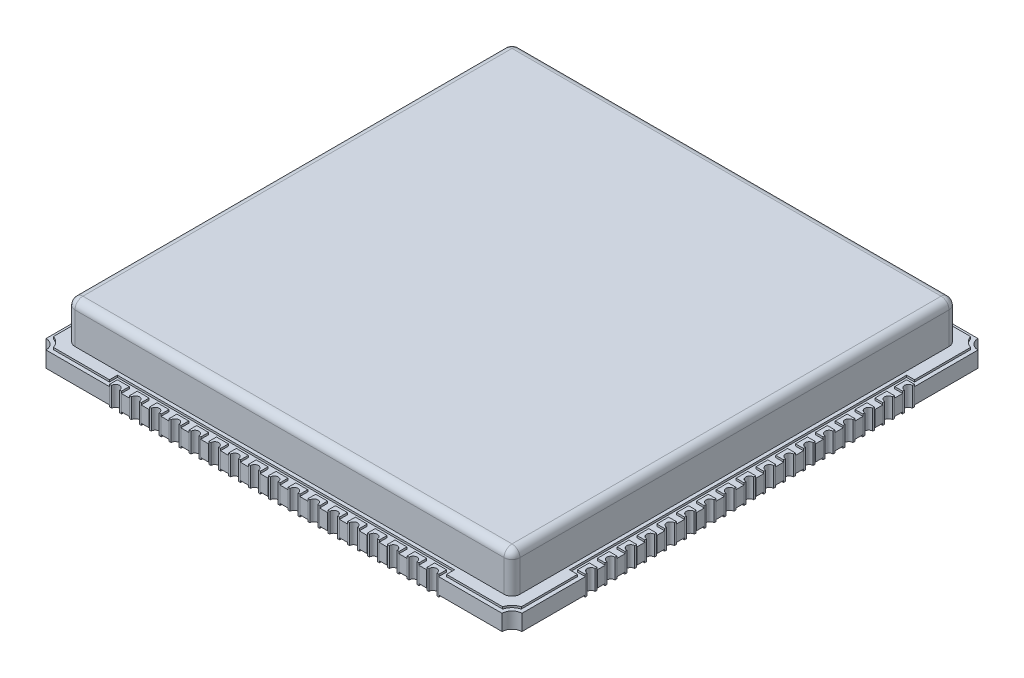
SolidWorks part; units mm, degrees
ref_plane "Front" through (0, 0, 0) normal (0, 0, 1) x (1, 0, 0)
ref_plane "Top" through (0, 0, 0) normal (0, 1, 0) x (1, 0, 0)
ref_plane "Right" through (0, 0, 0) normal (1, 0, 0) x (0, 0, -1)
sketch "Эскиз1" plane through (0, 0, 0) normal (0, 1, 0) x (1, 0, 0)
  line L1 (-12, -12) -> (12, -12)
  line L2 (-12, -12) -> (-12, 12)
  line L3 (-12, 12) -> (12, 12)
  line L4 (12, -12) -> (12, 12)
  line L5 (-12, -12) -> (12, 12) construction
  line L6 (-12, 12) -> (12, -12) construction
  point P0 (0, 0)
  dimension "D1" = 24
extrude "Вытянуть1" add sketch "Эскиз1" along normal blind 1
sketch "Эскиз3" plane through (0, 1, 0) normal (0, 1, 0) x (1, 0, 0)
  line L0 (-12, 12) -> (-12, -12) construction
  line L1 (-12, 8.3) -> (-11.8, 8.3)
  line L2 (-12, 8.3) -> (-12, 7.7)
  line L3 (-12, 7.7) -> (-11.8, 7.7)
  line L4 (-11.8, 8.3) -> (-11.8, 7.7)
  line L5 (12, 12) -> (-12, 12) construction
  line L6 (-8.3, 12) -> (-7.7, 12)
  line L7 (-8.3, 12) -> (-8.3, 11.8)
  line L8 (-8.3, 11.8) -> (-7.7, 11.8)
  line L9 (-7.7, 12) -> (-7.7, 11.8)
  line L10 (-12, 8) -> (-11.8, 8) construction
  line L11 (-8, 12) -> (-8, 11.8) construction
  line L12 (-7.3, 12) -> (-6.7, 12)
  line L13 (-7.3, 12) -> (-7.3, 11.8)
  line L14 (-7.3, 11.8) -> (-6.7, 11.8)
  line L15 (-6.7, 12) -> (-6.7, 11.8)
  line L16 (-6.3, 12) -> (-5.7, 12)
  line L17 (-6.3, 12) -> (-6.3, 11.8)
  line L18 (-6.3, 11.8) -> (-5.7, 11.8)
  line L19 (-5.7, 12) -> (-5.7, 11.8)
  line L20 (-5.3, 12) -> (-4.7, 12)
  line L21 (-5.3, 12) -> (-5.3, 11.8)
  line L22 (-5.3, 11.8) -> (-4.7, 11.8)
  line L23 (-4.7, 12) -> (-4.7, 11.8)
  line L24 (-4.3, 12) -> (-3.7, 12)
  line L25 (-4.3, 12) -> (-4.3, 11.8)
  line L26 (-4.3, 11.8) -> (-3.7, 11.8)
  line L27 (-3.7, 12) -> (-3.7, 11.8)
  line L28 (-3.3, 12) -> (-2.7, 12)
  line L29 (-3.3, 12) -> (-3.3, 11.8)
  line L30 (-3.3, 11.8) -> (-2.7, 11.8)
  line L31 (-2.7, 12) -> (-2.7, 11.8)
  line L32 (-2.3, 12) -> (-1.7, 12)
  line L33 (-2.3, 12) -> (-2.3, 11.8)
  line L34 (-2.3, 11.8) -> (-1.7, 11.8)
  line L35 (-1.7, 12) -> (-1.7, 11.8)
  line L36 (-1.3, 12) -> (-0.7, 12)
  line L37 (-1.3, 12) -> (-1.3, 11.8)
  line L38 (-1.3, 11.8) -> (-0.7, 11.8)
  line L39 (-0.7, 12) -> (-0.7, 11.8)
  line L40 (-0.3, 12) -> (0.3, 12)
  line L41 (-0.3, 12) -> (-0.3, 11.8)
  line L42 (-0.3, 11.8) -> (0.3, 11.8)
  line L43 (0.3, 12) -> (0.3, 11.8)
  line L44 (0.7, 12) -> (1.3, 12)
  line L45 (0.7, 12) -> (0.7, 11.8)
  line L46 (0.7, 11.8) -> (1.3, 11.8)
  line L47 (1.3, 12) -> (1.3, 11.8)
  line L48 (1.7, 12) -> (2.3, 12)
  line L49 (1.7, 12) -> (1.7, 11.8)
  line L50 (1.7, 11.8) -> (2.3, 11.8)
  line L51 (2.3, 12) -> (2.3, 11.8)
  line L52 (2.7, 12) -> (3.3, 12)
  line L53 (2.7, 12) -> (2.7, 11.8)
  line L54 (2.7, 11.8) -> (3.3, 11.8)
  line L55 (3.3, 12) -> (3.3, 11.8)
  line L56 (3.7, 12) -> (4.3, 12)
  line L57 (3.7, 12) -> (3.7, 11.8)
  line L58 (3.7, 11.8) -> (4.3, 11.8)
  line L59 (4.3, 12) -> (4.3, 11.8)
  line L60 (4.7, 12) -> (5.3, 12)
  line L61 (4.7, 12) -> (4.7, 11.8)
  line L62 (4.7, 11.8) -> (5.3, 11.8)
  line L63 (5.3, 12) -> (5.3, 11.8)
  line L64 (5.7, 12) -> (6.3, 12)
  line L65 (5.7, 12) -> (5.7, 11.8)
  line L66 (5.7, 11.8) -> (6.3, 11.8)
  line L67 (6.3, 12) -> (6.3, 11.8)
  line L68 (6.7, 12) -> (7.3, 12)
  line L69 (6.7, 12) -> (6.7, 11.8)
  line L70 (6.7, 11.8) -> (7.3, 11.8)
  line L71 (7.3, 12) -> (7.3, 11.8)
  line L72 (7.7, 12) -> (8.3, 12)
  line L73 (7.7, 12) -> (7.7, 11.8)
  line L74 (7.7, 11.8) -> (8.3, 11.8)
  line L75 (8.3, 12) -> (8.3, 11.8)
  line L76 (-8.3, -11.8) -> (-7.7, -11.8)
  line L77 (-8.3, -11.8) -> (-8.3, -12)
  line L78 (-8.3, -12) -> (-7.7, -12)
  line L79 (-7.7, -11.8) -> (-7.7, -12)
  line L80 (-7.3, -11.8) -> (-6.7, -11.8)
  line L81 (-7.3, -11.8) -> (-7.3, -12)
  line L82 (-7.3, -12) -> (-6.7, -12)
  line L83 (-6.7, -11.8) -> (-6.7, -12)
  line L84 (-6.3, -11.8) -> (-5.7, -11.8)
  line L85 (-6.3, -11.8) -> (-6.3, -12)
  line L86 (-6.3, -12) -> (-5.7, -12)
  line L87 (-5.7, -11.8) -> (-5.7, -12)
  line L88 (-5.3, -11.8) -> (-4.7, -11.8)
  line L89 (-5.3, -11.8) -> (-5.3, -12)
  line L90 (-5.3, -12) -> (-4.7, -12)
  line L91 (-4.7, -11.8) -> (-4.7, -12)
  line L92 (-4.3, -11.8) -> (-3.7, -11.8)
  line L93 (-4.3, -11.8) -> (-4.3, -12)
  line L94 (-4.3, -12) -> (-3.7, -12)
  line L95 (-3.7, -11.8) -> (-3.7, -12)
  line L96 (-3.3, -11.8) -> (-2.7, -11.8)
  line L97 (-3.3, -11.8) -> (-3.3, -12)
  line L98 (-3.3, -12) -> (-2.7, -12)
  line L99 (-2.7, -11.8) -> (-2.7, -12)
  line L100 (-2.3, -11.8) -> (-1.7, -11.8)
  line L101 (-2.3, -11.8) -> (-2.3, -12)
  line L102 (-2.3, -12) -> (-1.7, -12)
  line L103 (-1.7, -11.8) -> (-1.7, -12)
  line L104 (-1.3, -11.8) -> (-0.7, -11.8)
  line L105 (-1.3, -11.8) -> (-1.3, -12)
  line L106 (-1.3, -12) -> (-0.7, -12)
  line L107 (-0.7, -11.8) -> (-0.7, -12)
  line L108 (-0.3, -11.8) -> (0.3, -11.8)
  line L109 (-0.3, -11.8) -> (-0.3, -12)
  line L110 (-0.3, -12) -> (0.3, -12)
  line L111 (0.3, -11.8) -> (0.3, -12)
  line L112 (0.7, -11.8) -> (1.3, -11.8)
  line L113 (0.7, -11.8) -> (0.7, -12)
  line L114 (0.7, -12) -> (1.3, -12)
  line L115 (1.3, -11.8) -> (1.3, -12)
  line L116 (1.7, -11.8) -> (2.3, -11.8)
  line L117 (1.7, -11.8) -> (1.7, -12)
  line L118 (1.7, -12) -> (2.3, -12)
  line L119 (2.3, -11.8) -> (2.3, -12)
  line L120 (2.7, -11.8) -> (3.3, -11.8)
  line L121 (2.7, -11.8) -> (2.7, -12)
  line L122 (2.7, -12) -> (3.3, -12)
  line L123 (3.3, -11.8) -> (3.3, -12)
  line L124 (3.7, -11.8) -> (4.3, -11.8)
  line L125 (3.7, -11.8) -> (3.7, -12)
  line L126 (3.7, -12) -> (4.3, -12)
  line L127 (4.3, -11.8) -> (4.3, -12)
  line L128 (4.7, -11.8) -> (5.3, -11.8)
  line L129 (4.7, -11.8) -> (4.7, -12)
  line L130 (4.7, -12) -> (5.3, -12)
  line L131 (5.3, -11.8) -> (5.3, -12)
  line L132 (5.7, -11.8) -> (6.3, -11.8)
  line L133 (5.7, -11.8) -> (5.7, -12)
  line L134 (5.7, -12) -> (6.3, -12)
  line L135 (6.3, -11.8) -> (6.3, -12)
  line L136 (6.7, -11.8) -> (7.3, -11.8)
  line L137 (6.7, -11.8) -> (6.7, -12)
  line L138 (6.7, -12) -> (7.3, -12)
  line L139 (7.3, -11.8) -> (7.3, -12)
  line L140 (7.7, -11.8) -> (8.3, -11.8)
  line L141 (7.7, -11.8) -> (7.7, -12)
  line L142 (7.7, -12) -> (8.3, -12)
  line L143 (8.3, -11.8) -> (8.3, -12)
  line L144 (-12, -12) -> (12, -12) construction
  line L145 (11.8, 8.3) -> (12, 8.3)
  line L146 (11.8, 8.3) -> (11.8, 7.7)
  line L147 (11.8, 7.7) -> (12, 7.7)
  line L148 (12, 8.3) -> (12, 7.7)
  line L149 (-12, 7.3) -> (-11.8, 7.3)
  line L150 (-12, 7.3) -> (-12, 6.7)
  line L151 (-12, 6.7) -> (-11.8, 6.7)
  line L152 (-11.8, 7.3) -> (-11.8, 6.7)
  line L153 (11.8, 7.3) -> (12, 7.3)
  line L154 (11.8, 7.3) -> (11.8, 6.7)
  line L155 (11.8, 6.7) -> (12, 6.7)
  line L156 (12, 7.3) -> (12, 6.7)
  line L157 (-12, 6.3) -> (-11.8, 6.3)
  line L158 (-12, 6.3) -> (-12, 5.7)
  line L159 (-12, 5.7) -> (-11.8, 5.7)
  line L160 (-11.8, 6.3) -> (-11.8, 5.7)
  line L161 (11.8, 6.3) -> (12, 6.3)
  line L162 (11.8, 6.3) -> (11.8, 5.7)
  line L163 (11.8, 5.7) -> (12, 5.7)
  line L164 (12, 6.3) -> (12, 5.7)
  line L165 (-12, 5.3) -> (-11.8, 5.3)
  line L166 (-12, 5.3) -> (-12, 4.7)
  line L167 (-12, 4.7) -> (-11.8, 4.7)
  line L168 (-11.8, 5.3) -> (-11.8, 4.7)
  line L169 (11.8, 5.3) -> (12, 5.3)
  line L170 (11.8, 5.3) -> (11.8, 4.7)
  line L171 (11.8, 4.7) -> (12, 4.7)
  line L172 (12, 5.3) -> (12, 4.7)
  line L173 (-12, 4.3) -> (-11.8, 4.3)
  line L174 (-12, 4.3) -> (-12, 3.7)
  line L175 (-12, 3.7) -> (-11.8, 3.7)
  line L176 (-11.8, 4.3) -> (-11.8, 3.7)
  line L177 (11.8, 4.3) -> (12, 4.3)
  line L178 (11.8, 4.3) -> (11.8, 3.7)
  line L179 (11.8, 3.7) -> (12, 3.7)
  line L180 (12, 4.3) -> (12, 3.7)
  line L181 (-12, 3.3) -> (-11.8, 3.3)
  line L182 (-12, 3.3) -> (-12, 2.7)
  line L183 (-12, 2.7) -> (-11.8, 2.7)
  line L184 (-11.8, 3.3) -> (-11.8, 2.7)
  line L185 (11.8, 3.3) -> (12, 3.3)
  line L186 (11.8, 3.3) -> (11.8, 2.7)
  line L187 (11.8, 2.7) -> (12, 2.7)
  line L188 (12, 3.3) -> (12, 2.7)
  line L189 (-12, 2.3) -> (-11.8, 2.3)
  line L190 (-12, 2.3) -> (-12, 1.7)
  line L191 (-12, 1.7) -> (-11.8, 1.7)
  line L192 (-11.8, 2.3) -> (-11.8, 1.7)
  line L193 (11.8, 2.3) -> (12, 2.3)
  line L194 (11.8, 2.3) -> (11.8, 1.7)
  line L195 (11.8, 1.7) -> (12, 1.7)
  line L196 (12, 2.3) -> (12, 1.7)
  line L197 (-12, 1.3) -> (-11.8, 1.3)
  line L198 (-12, 1.3) -> (-12, 0.7)
  line L199 (-12, 0.7) -> (-11.8, 0.7)
  line L200 (-11.8, 1.3) -> (-11.8, 0.7)
  line L201 (11.8, 1.3) -> (12, 1.3)
  line L202 (11.8, 1.3) -> (11.8, 0.7)
  line L203 (11.8, 0.7) -> (12, 0.7)
  line L204 (12, 1.3) -> (12, 0.7)
  line L205 (-12, 0.3) -> (-11.8, 0.3)
  line L206 (-12, 0.3) -> (-12, -0.3)
  line L207 (-12, -0.3) -> (-11.8, -0.3)
  line L208 (-11.8, 0.3) -> (-11.8, -0.3)
  line L209 (11.8, 0.3) -> (12, 0.3)
  line L210 (11.8, 0.3) -> (11.8, -0.3)
  line L211 (11.8, -0.3) -> (12, -0.3)
  line L212 (12, 0.3) -> (12, -0.3)
  line L213 (-12, -0.7) -> (-11.8, -0.7)
  line L214 (-12, -0.7) -> (-12, -1.3)
  line L215 (-12, -1.3) -> (-11.8, -1.3)
  line L216 (-11.8, -0.7) -> (-11.8, -1.3)
  line L217 (11.8, -0.7) -> (12, -0.7)
  line L218 (11.8, -0.7) -> (11.8, -1.3)
  line L219 (11.8, -1.3) -> (12, -1.3)
  line L220 (12, -0.7) -> (12, -1.3)
  line L221 (-12, -1.7) -> (-11.8, -1.7)
  line L222 (-12, -1.7) -> (-12, -2.3)
  line L223 (-12, -2.3) -> (-11.8, -2.3)
  line L224 (-11.8, -1.7) -> (-11.8, -2.3)
  line L225 (11.8, -1.7) -> (12, -1.7)
  line L226 (11.8, -1.7) -> (11.8, -2.3)
  line L227 (11.8, -2.3) -> (12, -2.3)
  line L228 (12, -1.7) -> (12, -2.3)
  line L229 (-12, -2.7) -> (-11.8, -2.7)
  line L230 (-12, -2.7) -> (-12, -3.3)
  line L231 (-12, -3.3) -> (-11.8, -3.3)
  line L232 (-11.8, -2.7) -> (-11.8, -3.3)
  line L233 (11.8, -2.7) -> (12, -2.7)
  line L234 (11.8, -2.7) -> (11.8, -3.3)
  line L235 (11.8, -3.3) -> (12, -3.3)
  line L236 (12, -2.7) -> (12, -3.3)
  line L237 (-12, -3.7) -> (-11.8, -3.7)
  line L238 (-12, -3.7) -> (-12, -4.3)
  line L239 (-12, -4.3) -> (-11.8, -4.3)
  line L240 (-11.8, -3.7) -> (-11.8, -4.3)
  line L241 (11.8, -3.7) -> (12, -3.7)
  line L242 (11.8, -3.7) -> (11.8, -4.3)
  line L243 (11.8, -4.3) -> (12, -4.3)
  line L244 (12, -3.7) -> (12, -4.3)
  line L245 (-12, -4.7) -> (-11.8, -4.7)
  line L246 (-12, -4.7) -> (-12, -5.3)
  line L247 (-12, -5.3) -> (-11.8, -5.3)
  line L248 (-11.8, -4.7) -> (-11.8, -5.3)
  line L249 (11.8, -4.7) -> (12, -4.7)
  line L250 (11.8, -4.7) -> (11.8, -5.3)
  line L251 (11.8, -5.3) -> (12, -5.3)
  line L252 (12, -4.7) -> (12, -5.3)
  line L253 (-12, -5.7) -> (-11.8, -5.7)
  line L254 (-12, -5.7) -> (-12, -6.3)
  line L255 (-12, -6.3) -> (-11.8, -6.3)
  line L256 (-11.8, -5.7) -> (-11.8, -6.3)
  line L257 (11.8, -5.7) -> (12, -5.7)
  line L258 (11.8, -5.7) -> (11.8, -6.3)
  line L259 (11.8, -6.3) -> (12, -6.3)
  line L260 (12, -5.7) -> (12, -6.3)
  line L261 (-12, -6.7) -> (-11.8, -6.7)
  line L262 (-12, -6.7) -> (-12, -7.3)
  line L263 (-12, -7.3) -> (-11.8, -7.3)
  line L264 (-11.8, -6.7) -> (-11.8, -7.3)
  line L265 (11.8, -6.7) -> (12, -6.7)
  line L266 (11.8, -6.7) -> (11.8, -7.3)
  line L267 (11.8, -7.3) -> (12, -7.3)
  line L268 (12, -6.7) -> (12, -7.3)
  line L269 (-12, -7.7) -> (-11.8, -7.7)
  line L270 (-12, -7.7) -> (-12, -8.3)
  line L271 (-12, -8.3) -> (-11.8, -8.3)
  line L272 (-11.8, -7.7) -> (-11.8, -8.3)
  line L273 (11.8, -7.7) -> (12, -7.7)
  line L274 (11.8, -7.7) -> (11.8, -8.3)
  line L275 (11.8, -8.3) -> (12, -8.3)
  line L276 (12, -7.7) -> (12, -8.3)
  line L277 (12, -12) -> (12, 12) construction
  circle A0 centre (-12, 12) radius 0.5
  circle A1 centre (12, 12) radius 0.5
  circle A2 centre (12, -12) radius 0.5
  circle A3 centre (-12, -12) radius 0.5
  dimension "D1" = 1
  dimension "D2" = 0.6
  dimension "A" = 8
  dimension "D3" = 0.2
  dimension "D4" = 1
  dimension "D5" = 1
extrude "Вытянуть3" cut sketch "Эскиз3" against normal through all
sketch "Эскиз4" plane through (0, 1, 0) normal (0, 1, 0) x (1, 0, 0)
  line L18 (-11.8, -8.5) -> (-11.8, -11.3292)
  line L19 (-8.5, 11.8) -> (-11.3292, 11.8)
  line L22 (-8.5, 11.8) -> (-8.5, 11.4)
  line L24 (-8.5, 11.4) -> (8.5, 11.4)
  line L29 (-11.8, 11.8) -> (-11.8, -11.8)
  line L33 (-11.8, -11.8) -> (11.8, -11.8)
  line L34 (11.8, -11.8) -> (11.8, 11.8)
  line L35 (11.8, 11.8) -> (-11.8, 11.8)
  line L36 (-11.8, 11.3292) -> (-11.8, 8.5)
  line L37 (-11.3292, -11.8) -> (-8.5, -11.8)
  line L38 (11.8, -11.3292) -> (11.8, -8.5)
  line L39 (11.3292, 11.8) -> (8.5, 11.8)
  line L40 (8.5, 11.8) -> (8.5, 11.4)
  line L41 (-11.8, 8.5) -> (-11.4, 8.5)
  line L42 (11.8, 8.5) -> (11.8, 11.3292)
  line L43 (-11.8, -8.5) -> (-11.4, -8.5)
  line L44 (-11.4, 8.5) -> (-11.4, -8.5)
  line L45 (-11.8, 8.3) -> (-12, 8.3) construction
  line L46 (-8.5, -11.8) -> (-8.5, -11.4)
  line L47 (-8.5, -11.4) -> (8.5, -11.4)
  line L48 (8.5, -11.8) -> (8.5, -11.4)
  line L49 (11.8, -8.5) -> (11.4, -8.5)
  line L50 (8.5, -11.8) -> (11.3292, -11.8)
  line L51 (11.8, 8.5) -> (11.4, 8.5)
  line L52 (11.4, -8.5) -> (11.4, 8.5)
  line L53 (-11.8, 7.7) -> (-11.8, 8.3) construction
  line L54 (-12, -8.3) -> (-11.8, -8.3) construction
  line L55 (-8.3, 12) -> (-8.3, 11.8) construction
  line L56 (12, 8.3) -> (11.8, 8.3) construction
  line L57 (-8.3, -11.8) -> (-8.3, -12) construction
  arc A4 (-11.5, -12) -> (-12, -11.5) centre (-12, -12) ccw construction
  arc A5 (12, -11.5) -> (11.5, -12) centre (12, -12) ccw construction
  arc A6 (11.5, 12) -> (12, 11.5) centre (12, 12) ccw construction
  arc A7 (-12, 11.5) -> (-11.5, 12) centre (-12, 12) ccw construction
  arc A28 (-11.5, -12) -> (-12, -11.5) centre (-12, -12) ccw construction
  arc A29 (12, -11.5) -> (11.5, -12) centre (12, -12) ccw construction
  arc A30 (11.5, 12) -> (12, 11.5) centre (12, 12) ccw construction
  arc A31 (-12, 11.5) -> (-11.5, 12) centre (-12, 12) ccw construction
  arc A32 (-11.8, 11.3292) -> (-11.3292, 11.8) centre (-12, 12) ccw
  arc A33 (11.3292, 11.8) -> (11.8, 11.3292) centre (12, 12) ccw
  arc A34 (11.8, -11.3292) -> (11.3292, -11.8) centre (12, -12) ccw
  arc A35 (-11.3292, -11.8) -> (-11.8, -11.3292) centre (-12, -12) ccw
  arc A37 (12, -11.3) -> (11.3, -12) centre (12, -12) ccw construction
  arc A38 (11.3, 12) -> (12, 11.3) centre (12, 12) ccw construction
  arc A39 (11.5, 12) -> (12, 11.5) centre (12, 12) ccw construction
  arc A40 (-12, 11.3) -> (-11.3, 12) centre (-12, 12) ccw construction
  arc A41 (-11.3, -12) -> (-12, -11.3) centre (-12, -12) ccw construction
  point P2 (-11.8, 11.3292)
  point P4 (-11.8, -11.3292)
  point P10 (-11.3292, -11.8)
  point P16 (11.3292, -11.8)
  point P18 (11.8, -11.3292)
  point P19 (11.8, 11.3292)
  point P21 (11.3292, 11.8)
  point P22 (-11.3292, 11.8)
  dimension "D3" = 0.2
  dimension "D4" = 0.4
  dimension "D5" = 0.2
  dimension "D6" = 0.2
  dimension "D7" = 0.2
  dimension "D8" = 0.2
  dimension "D1" = 0.2
  dimension "D2" = 0.2
extrude "Вытянуть4" cut sketch "Эскиз4" against normal blind 0.1 flip side to cut
sketch "Эскиз5" plane through (0, 0, 0) normal (0, -1, 0) x (1, 0, 0)
  line L0 (-12, -12.5) -> (-12, -8.3) construction
  line L1 (-8.5, -10.8) -> (8.5, -10.8)
  line L2 (-10.8, -8.5) -> (-10.8, 8.5)
  line L3 (-8.5, 10.8) -> (8.5, 10.8)
  line L4 (10.8, -8.5) -> (10.8, 8.5)
  line L5 (-8.3, -12) -> (-11.5, -12) construction
  line L10 (12, -8.3) -> (12, -11.5) construction
  line L13 (-6.5, 0) -> (0, 0) construction
  line L20 (-8.5, 11.8) -> (-11.3292, 11.8)
  line L21 (-8.5, 11.4) -> (-8.5, 11.8)
  line L22 (8.5, 11.4) -> (-8.5, 11.4)
  line L23 (8.5, 11.8) -> (8.5, 11.4)
  line L24 (11.3292, 11.8) -> (8.5, 11.8)
  line L25 (11.8, 8.5) -> (11.8, 11.3292)
  line L26 (11.4, 8.5) -> (11.8, 8.5)
  line L27 (11.4, -8.5) -> (11.4, 8.5)
  line L28 (11.8, -8.5) -> (11.4, -8.5)
  line L29 (11.8, -11.3292) -> (11.8, -8.5)
  line L30 (8.5, -11.8) -> (11.3292, -11.8)
  line L31 (8.5, -11.4) -> (8.5, -11.8)
  line L32 (-8.5, -11.4) -> (8.5, -11.4)
  line L33 (-8.5, -11.8) -> (-8.5, -11.4)
  line L34 (-11.3292, -11.8) -> (-8.5, -11.8)
  line L35 (-11.8, -8.5) -> (-11.8, -11.3292)
  line L36 (-11.4, -8.5) -> (-11.8, -8.5)
  line L37 (-11.4, 8.5) -> (-11.4, -8.5)
  line L38 (-11.8, 8.5) -> (-11.4, 8.5)
  line L39 (-11.8, 11.3292) -> (-11.8, 8.5)
  line L40 (-8.5, 11.8) -> (-11.3292, 11.8)
  line L41 (-8.5, 10.8) -> (-8.5, 11.8)
  line L43 (8.5, 11.8) -> (8.5, 10.8)
  line L44 (11.3292, 11.8) -> (8.5, 11.8)
  line L45 (11.8, 8.5) -> (11.8, 11.3292)
  line L46 (10.8, 8.5) -> (11.8, 8.5)
  line L48 (11.8, -8.5) -> (10.8, -8.5)
  line L49 (11.8, -11.3292) -> (11.8, -8.5)
  line L50 (8.5, -11.8) -> (11.3292, -11.8)
  line L51 (8.5, -10.8) -> (8.5, -11.8)
  line L53 (-8.5, -11.8) -> (-8.5, -10.8)
  line L54 (-11.3292, -11.8) -> (-8.5, -11.8)
  line L55 (-11.8, -8.5) -> (-11.8, -11.3292)
  line L56 (-10.8, -8.5) -> (-11.8, -8.5)
  line L58 (-11.8, 8.5) -> (-10.8, 8.5)
  line L59 (-11.8, 11.3292) -> (-11.8, 8.5)
  circle A0 centre (-0.5, -8) radius 1.5
  circle A1 centre (-6.5, 2) radius 0.75
  circle A2 centre (-4.5, 2) radius 0.75
  circle A3 centre (-2.5, 2) radius 0.75
  arc A4 (-11.8, 11.3292) -> (-11.3292, 11.8) centre (-12, 12) ccw
  arc A5 (11.3292, 11.8) -> (11.8, 11.3292) centre (12, 12) ccw
  arc A6 (11.8, -11.3292) -> (11.3292, -11.8) centre (12, -12) ccw
  arc A7 (-11.3292, -11.8) -> (-11.8, -11.3292) centre (-12, -12) ccw
  arc A8 (-11.8, 11.3292) -> (-11.3292, 11.8) centre (-12, 12) ccw
  arc A9 (11.3292, 11.8) -> (11.8, 11.3292) centre (12, 12) ccw
  arc A10 (11.8, -11.3292) -> (11.3292, -11.8) centre (12, -12) ccw
  arc A11 (-11.3292, -11.8) -> (-11.8, -11.3292) centre (-12, -12) ccw
  circle A12 centre (-6.5, 0) radius 0.75
  circle A13 centre (-4.5, 0) radius 0.75
  circle A14 centre (-2.5, 0) radius 0.75
  circle A15 centre (-6.5, -2) radius 0.75
  circle A16 centre (-4.5, -2) radius 0.75
  circle A17 centre (-2.5, -2) radius 0.75
  dimension "D4" = 12.5
  dimension "D9" = 2
  dimension "D10" = 2
  dimension "D11" = 1.5
  dimension "D12" = 6.5
  dimension "D5" = 3
  dimension "D3" = 4
  dimension "D2" = 1.2
  dimension "D1" = 0
extrude "Вытянуть5" cut sketch "Эскиз5" against normal blind 0.1 flip side to cut
ref_plane "Плоскость1" through (0, 0, -8) normal (0, 0, 1) x (1, 0, 0)
sketch "Эскиз9" plane through (0, 0, -8) normal (0, 0, 1) x (1, 0, 0)
  line L0 (-11.99, 1) -> (-11.99, 0)
  line L1 (-11.99, 0) -> (-11, 0)
  line L2 (-10.8, 0) -> (-11.8, 0) construction
  line L5 (-11, 0) -> (-11, 0.1)
  line L6 (0, 0) -> (0, 1) construction
  line L8 (-11, 0.1) -> (-11.6, 0.1)
  line L10 (-11.6, 0.1) -> (-11.6, 1)
  line L11 (-11.8, 1) -> (-11.4, 1) construction
  line L12 (-11.6, 1) -> (-11.99, 1)
  line L13 (-12, 0.1) -> (-12, 0.9) construction
  line L14 (-11.4, 0.9) -> (-11.4, 1) construction
  line L15 (-10.8, 0.1) -> (-10.8, 0) construction
  line L16 (-8.5, 1) -> (8.5, 1) construction
  line L17 (11.6, 1) -> (11.99, 1)
  line L18 (11.6, 0.1) -> (11.6, 1)
  line L19 (11, 0.1) -> (11.6, 0.1)
  line L20 (11, 0) -> (11, 0.1)
  line L21 (11.99, 0) -> (11, 0)
  line L22 (11.99, 1) -> (11.99, 0)
  line L23 (-11.8, 0.1) -> (-12, 0.1) construction
  dimension "D1" = 0.01
  dimension "D2" = 0.2
  dimension "D3" = 0.2
extrude "Вытянуть7" add sketch "Эскиз9" along normal mid plane 0.6
ref_plane "Плоскость2" through (-8, 0, 0) normal (1, 0, 0) x (0, 0, -1)
sketch "Эскиз10" plane through (-8, 0, 0) normal (1, 0, 0) x (0, 0, -1)
  line L0 (11.6, 0.1) -> (11.6, 1)
  line L2 (11.4, 1) -> (11.8, 1) construction
  line L3 (11.6, 1) -> (11.99, 1)
  line L4 (11.99, 1) -> (11.99, 0)
  line L5 (11.99, 0) -> (11, 0)
  line L6 (11.8, 0) -> (10.8, 0) construction
  line L7 (11, 0) -> (11, 0.1)
  line L9 (11, 0.1) -> (11.6, 0.1)
  line L10 (12, 0.1) -> (12, 0.9) construction
  line L11 (11.4, 0.9) -> (11.4, 1) construction
  line L12 (10.8, 0.1) -> (10.8, 0) construction
  line L13 (0, 0) -> (0, 1) construction
  line L14 (8.5, 1) -> (-8.5, 1) construction
  line L15 (-11, 0.1) -> (-11.6, 0.1)
  line L16 (-11, 0) -> (-11, 0.1)
  line L17 (-11.99, 0) -> (-11, 0)
  line L18 (-11.99, 1) -> (-11.99, 0)
  line L19 (-11.6, 1) -> (-11.99, 1)
  line L20 (-11.6, 0.1) -> (-11.6, 1)
  line L21 (12, 0.1) -> (11.8, 0.1) construction
  dimension "D1" = 0.01
  dimension "D2" = 0.2
  dimension "D3" = 0.2
extrude "Вытянуть8" add sketch "Эскиз10" along normal mid plane 0.6
pattern_linear "Линейный массив1" count 17 spacing 1 along (0, 0, 1) of "Вытянуть7"
pattern_linear "Линейный массив2" count 17 spacing 1 along (1, 0, 0) of "Вытянуть8"
sketch "Эскиз11" plane through (0, 1, 0) normal (0, 1, 0) x (1, 0, 0)
  line L0 (-11.99, 7.7) -> (-11.99, 8.3) construction
  line L1 (-7.7, 11.99) -> (-8.3, 11.99) construction
  line L2 (-11.99, 6.7) -> (-11.99, 7.3) construction
  line L3 (11.99, 7.7) -> (11.99, 8.3) construction
  line L4 (-6.7, 11.99) -> (-7.3, 11.99) construction
  line L5 (-7.7, -11.99) -> (-8.3, -11.99) construction
  circle A0 centre (-11.99, 8) radius 0.2
  circle A1 centre (-8, 11.99) radius 0.2
  circle A2 centre (11.99, 8) radius 0.2
  circle A3 centre (-11.99, 7) radius 0.2
  circle A4 centre (11.99, 7) radius 0.2
  circle A5 centre (-11.99, 6) radius 0.2
  circle A6 centre (11.99, 6) radius 0.2
  circle A7 centre (-11.99, 5) radius 0.2
  circle A8 centre (11.99, 5) radius 0.2
  circle A9 centre (-11.99, 4) radius 0.2
  circle A10 centre (11.99, 4) radius 0.2
  circle A11 centre (-11.99, 3) radius 0.2
  circle A12 centre (11.99, 3) radius 0.2
  circle A13 centre (-11.99, 2) radius 0.2
  circle A14 centre (11.99, 2) radius 0.2
  circle A15 centre (-11.99, 1) radius 0.2
  circle A16 centre (11.99, 1) radius 0.2
  circle A17 centre (-11.99, 0) radius 0.2
  circle A18 centre (11.99, 0) radius 0.2
  circle A19 centre (-11.99, -1) radius 0.2
  circle A20 centre (11.99, -1) radius 0.2
  circle A21 centre (-11.99, -2) radius 0.2
  circle A22 centre (11.99, -2) radius 0.2
  circle A23 centre (-11.99, -3) radius 0.2
  circle A24 centre (11.99, -3) radius 0.2
  circle A25 centre (-11.99, -4) radius 0.2
  circle A26 centre (11.99, -4) radius 0.2
  circle A27 centre (-11.99, -5) radius 0.2
  circle A28 centre (11.99, -5) radius 0.2
  circle A29 centre (-11.99, -6) radius 0.2
  circle A30 centre (11.99, -6) radius 0.2
  circle A31 centre (-11.99, -7) radius 0.2
  circle A32 centre (11.99, -7) radius 0.2
  circle A33 centre (-11.99, -8) radius 0.2
  circle A34 centre (11.99, -8) radius 0.2
  circle A35 centre (-7, 11.99) radius 0.2
  circle A36 centre (-6, 11.99) radius 0.2
  circle A37 centre (-5, 11.99) radius 0.2
  circle A38 centre (-4, 11.99) radius 0.2
  circle A39 centre (-3, 11.99) radius 0.2
  circle A40 centre (-2, 11.99) radius 0.2
  circle A41 centre (-1, 11.99) radius 0.2
  circle A42 centre (0, 11.99) radius 0.2
  circle A43 centre (1, 11.99) radius 0.2
  circle A44 centre (2, 11.99) radius 0.2
  circle A45 centre (3, 11.99) radius 0.2
  circle A46 centre (4, 11.99) radius 0.2
  circle A47 centre (5, 11.99) radius 0.2
  circle A48 centre (6, 11.99) radius 0.2
  circle A49 centre (7, 11.99) radius 0.2
  circle A50 centre (8, 11.99) radius 0.2
  circle A51 centre (-8, -11.99) radius 0.2
  circle A52 centre (-7, -11.99) radius 0.2
  circle A53 centre (-6, -11.99) radius 0.2
  circle A54 centre (-5, -11.99) radius 0.2
  circle A55 centre (-4, -11.99) radius 0.2
  circle A56 centre (-3, -11.99) radius 0.2
  circle A57 centre (-2, -11.99) radius 0.2
  circle A58 centre (-1, -11.99) radius 0.2
  circle A59 centre (0, -11.99) radius 0.2
  circle A60 centre (1, -11.99) radius 0.2
  circle A61 centre (2, -11.99) radius 0.2
  circle A62 centre (3, -11.99) radius 0.2
  circle A63 centre (4, -11.99) radius 0.2
  circle A64 centre (5, -11.99) radius 0.2
  circle A65 centre (6, -11.99) radius 0.2
  circle A66 centre (7, -11.99) radius 0.2
  circle A67 centre (8, -11.99) radius 0.2
  dimension "D1" = 0.4
extrude "Вытянуть9" cut sketch "Эскиз11" against normal through all
sketch "Эскиз12" plane through (0, 0.1, 0) normal (0, -1, 0) x (1, 0, 0)
  circle A0 centre (-2.5, 2) radius 0.75 construction
  circle A1 centre (-2.5, 0) radius 0.75 construction
  circle A2 centre (-4.5, 0) radius 0.75 construction
  circle A3 centre (-4.5, 2) radius 0.75 construction
  circle A4 centre (-6.5, 2) radius 0.75 construction
  circle A5 centre (-6.5, 0) radius 0.75 construction
  circle A6 centre (-6.5, -2) radius 0.75 construction
  circle A7 centre (-4.5, -2) radius 0.75 construction
  circle A8 centre (-2.5, -2) radius 0.75 construction
  circle A9 centre (-0.5, -8) radius 1.5 construction
  circle A30 centre (-2.5, 2) radius 0.75 construction
  circle A31 centre (-2.5, 0) radius 0.75 construction
  circle A32 centre (-4.5, 0) radius 0.75 construction
  circle A33 centre (-4.5, 2) radius 0.75 construction
  circle A34 centre (-6.5, 2) radius 0.75 construction
  circle A35 centre (-6.5, 0) radius 0.75 construction
  circle A36 centre (-6.5, -2) radius 0.75 construction
  circle A37 centre (-4.5, -2) radius 0.75 construction
  circle A38 centre (-2.5, -2) radius 0.75 construction
  circle A39 centre (-0.5, -8) radius 1.5 construction
  circle A40 centre (-2.5, 2) radius 0.55
  circle A41 centre (-2.5, 0) radius 0.55
  circle A42 centre (-4.5, 0) radius 0.55
  circle A43 centre (-4.5, 2) radius 0.55
  circle A44 centre (-6.5, 2) radius 0.55
  circle A45 centre (-6.5, 0) radius 0.55
  circle A46 centre (-6.5, -2) radius 0.55
  circle A47 centre (-4.5, -2) radius 0.55
  circle A48 centre (-2.5, -2) radius 0.55
  circle A49 centre (-0.5, -8) radius 1.3
  dimension "D1" = 0.2
extrude "Вытянуть10" add sketch "Эскиз12" along normal blind 0.1
sketch "Эскиз2" plane through (0, 1, 0) normal (0, 1, 0) x (1, 0, 0)
  line L1 (11.22, -11.22) -> (-11.22, -11.22)
  line L2 (11.22, -11.22) -> (11.22, 11.22)
  line L3 (11.22, 11.22) -> (-11.22, 11.22)
  line L4 (-11.22, -11.22) -> (-11.22, 11.22)
  line L5 (11.22, -11.22) -> (-11.22, 11.22) construction
  line L6 (11.22, 11.22) -> (-11.22, -11.22) construction
  point P0 (0, 0)
  dimension "D1" = 22.44
extrude "Вытянуть2" add sketch "Эскиз2" along normal blind 2
fillet "Скругление1" radius 0.4 8 edges at (0, 3, -11.22) (11.22, 3, 0) (0, 3, 11.22) (-11.22, 3, 0) (-11.22, 2, -11.22) (11.22, 2, -11.22) (11.22, 2, 11.22) (-11.22, 2, 11.22)
